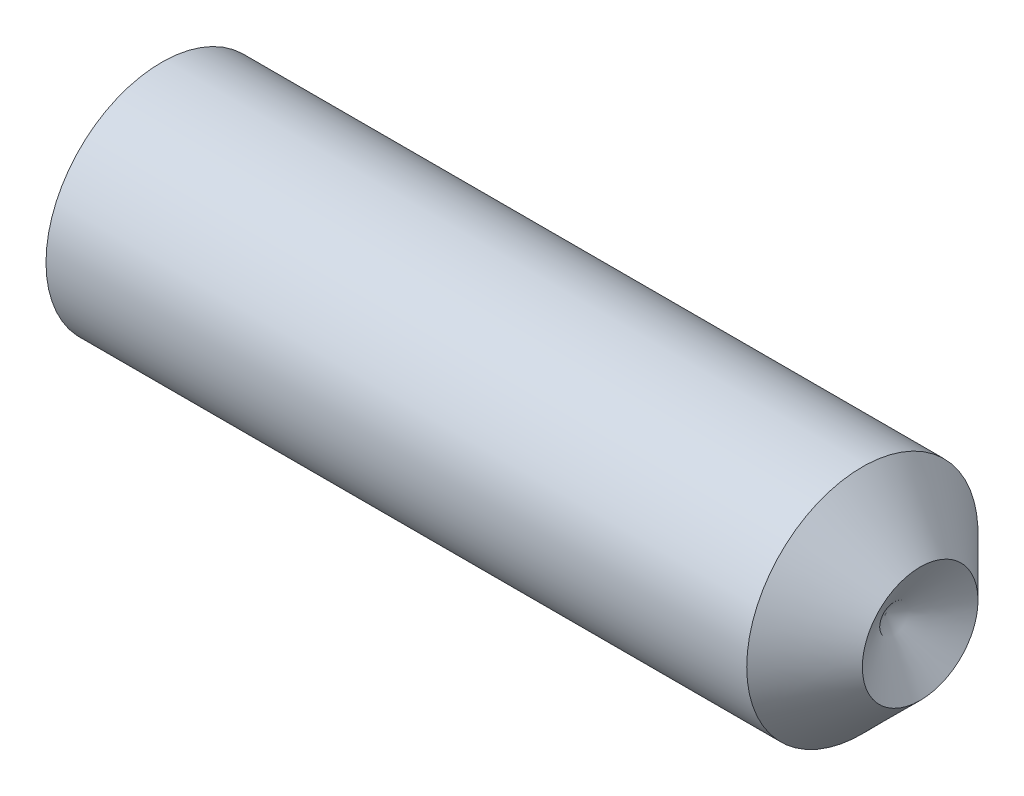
SolidWorks part; units mm, degrees
ref_plane "Plane1" through (0, 0, 0) normal (0, 0, 1) x (1, 0, 0)
ref_plane "Plane2" through (0, 0, 0) normal (0, 1, 0) x (1, 0, 0)
ref_plane "Plane3" through (0, 0, 0) normal (1, 0, 0) x (0, 0, -1)
sketch "BodySke" plane through (0, 0, 0) normal (0, 0, 1) x (1, 0, 0)
  line L0 (0, 0) -> (0, 2.4455)
  line L1 (0, 2.4455) -> (0.3201, 3)
  line L2 (0.3201, 3) -> (18.5, 3)
  line L3 (18.5, 3) -> (20, 1.5)
  line L4 (19.0987, 0) -> (0, 0)
  line L5 (-12.7, 0) -> (88.9, 0) construction
  line L6 (19.0987, 0) -> (20, 1.5)
  line L7 (20, 1.5) -> (20, 11.025) construction
  line L8 (0, -2.4455) -> (0.3201, -3) construction
  line L9 (19.0987, 0) -> (20, -1.5) construction
  line L10 (18.5, -3) -> (20, -1.5) construction
  line L11 (1, 15.875) -> (1, -3.175) construction
  dimension "Length" = 20
  dimension "Diameter" = 6
  dimension "Drive_ch_ang" = 60
  dimension "Minor_dia" = 4.891
  dimension "Cup_nose_ang" = 45
  dimension "Cup_ang" = 118
  dimension "Cup_dia" = 3
  dimension "Advance" = 1
revolve "BaseBody" add sketch "BodySke" angle 360 about L5
sketch "Sketch2" plane through (0, 0, 0) normal (-1, 0, 0) x (0, 0, 1)
  line L0 (0.866, 1.5) -> (-0.866, 1.5)
  line L1 (-0.866, 1.5) -> (-1.7321, 0)
  line L2 (0.866, 1.5) -> (1.7321, 0)
  line L3 (0.866, -1.5) -> (1.7321, 0)
  line L4 (0.866, -1.5) -> (-0.866, -1.5)
  line L5 (-0.866, -1.5) -> (-1.7321, 0)
  dimension "Hex_size" = 3
  dimension "D2" = 1.5
  dimension "D3" = 1.5
extrude "Hex" cut sketch "Sketch2" against normal blind 3
sketch "Sketch4" plane through (0, 4.7709, -0.5249) normal (-1, 0, 0) x (0, 0, 1)
  line L0 (0.5249, -4.7709) -> (2.4174, -4.7709)
  line L1 (0.5249, -4.7709) -> (6.6732, -1.2211) construction
  line L2 (0.5249, -4.7709) -> (1.4711, -3.1319)
  line L3 (2.0911, -4.336) -> (2.3288, -4.1987)
  line L4 (1.6846, -3.6319) -> (1.9223, -3.4947)
  arc A0 (2.0911, -4.336) -> (1.6846, -3.6319) centre (0.5249, -4.7709) ccw
  arc A1 (2.4174, -4.7709) -> (2.3288, -4.1987) centre (0.5249, -4.7709) ccw
  arc A2 (1.4711, -3.1319) -> (1.9223, -3.4947) centre (0.5249, -4.7709) cw
  circle A3 centre (0.5249, -4.7709) radius 1.6255 construction
  circle A4 centre (0.5249, -4.7709) radius 1.8925 construction
  dimension "D1" = 30
  dimension "Spline_n_dim" = 3.251
  dimension "Spline_m_dim" = 3.785
  dimension "Spline_a_dim" = 60
  dimension "D3" = 0.4065
  dimension "Spline_p_dim" = 0.813
extrude "Spline6" [suppressed] cut sketch "Sketch4" against normal blind 3
pattern_circular "CirPattern1" [suppressed] count 6 every 60 about axis through (-12.7, 0, 0) along (1, 0, 0)
sketch "Sketch5" plane through (0, 1.5227, 6.1981) normal (-1, 0, 0) x (0, 0, 1)
  line L0 (-6.1981, -1.5227) -> (-4.3056, -1.5227)
  line L1 (-6.1981, -1.5227) -> (-1.178, 3.4975) construction
  line L2 (-6.1981, -1.5227) -> (-6.1981, 0.3698)
  line L3 (-4.7612, -0.6607) -> (-4.6037, -0.5031)
  line L4 (-5.3361, -0.0858) -> (-5.1786, 0.0718)
  line L5 (-5.3361, -0.0858) -> (-4.7612, -0.6607)
  arc A1 (-4.3056, -1.5227) -> (-4.6037, -0.5031) centre (-6.1981, -1.5227) ccw
  arc A2 (-6.1981, 0.3698) -> (-5.1786, 0.0718) centre (-6.1981, -1.5227) cw
  circle A3 centre (-6.1981, -1.5227) radius 1.6255 construction
  circle A4 centre (-6.1981, -1.5227) radius 1.8925 construction
  dimension "D1" = 45
  dimension "Spline_n_dim" = 3.251
  dimension "Spline_m_dim" = 3.785
  dimension "Spline_a_dim" = 90
  dimension "D3" = 0.4065
  dimension "Spline_p_dim" = 0.813
extrude "Spline4" [suppressed] cut sketch "Sketch5" against normal blind 3
pattern_circular "CirPattern2" [suppressed] count 4 every 90 about axis through (-12.7, 0, 0) along (1, 0, 0)
sketch "ThdSchSke" plane through (0, 0, 0) normal (0, 0, 1) x (1, 0, 0)
  line L0 (0.3201, -2.4455) -> (-0.0681, -3)
  line L1 (0.3201, -2.4455) -> (0.7084, -3)
  line L2 (0.7084, -3) -> (0.7084, -3.75)
  line L3 (-3.175, 0) -> (5.1513, 0) construction
  line L4 (0.3201, 3) -> (0.3201, -3) construction
  line L5 (0.7084, -3.75) -> (-0.0681, -3.75)
  line L6 (-0.0681, -3.75) -> (-0.0681, -3)
  dimension "Thread_minor" = 4.891
  dimension "Diameter" = 6
  dimension "SideAngle" = 55
  dimension "VeeAngle" = 70
  dimension "Overcut" = 7.5
revolve "ThreadSchematic" [suppressed] cut sketch "ThdSchSke" angle 360 about L3
pattern_linear "ThdSchPat" [suppressed]
equation "\"D2@Sketch2\" = \"Hex_size@Sketch2\" / 2"
equation "\"D3@Sketch2\" = \"Hex_size@Sketch2\" / 2"
equation "\"Thread_minor@ThreadCosmetic\" = \"Minor_dia@BodySke\""
equation "\"D1@Sketch4\" = \"Spline_a_dim@Sketch4\" / 2"
equation "\"D3@Sketch4\" = \"Spline_p_dim@Sketch4\" / 2"
equation "\"D2@CirPattern1\" = \"Spline_a_dim@Sketch4\""
equation "\"Num_teeth@CirPattern1\" = 360 / \"D2@CirPattern1\""
equation "\"Spline_a_dim@Sketch5\" = 90"
equation "\"Spline_p_dim@Sketch5\" = \"Spline_p_dim@Sketch4\""
equation "\"Spline_m_dim@Sketch5\" = \"Spline_m_dim@Sketch4\""
equation "\"Spline_n_dim@Sketch5\" = \"Spline_n_dim@Sketch4\""
equation "\"D1@Sketch5\" = \"Spline_a_dim@Sketch5\" / 2"
equation "\"D3@Sketch5\" = \"Spline_p_dim@Sketch5\" / 2"
equation "\"Key_eng@Spline4\" = \"Key_eng@Spline6\""
equation "\"Thread_minor@ThdSchSke\" = \"Thread_minor@ThreadCosmetic\""
equation "\"Diameter@ThdSchSke\" = \"Diameter@BodySke\""
equation "\"Overcut@ThdSchSke\" = \"Diameter@BodySke\" * 1.25"
equation "\"Num_threads@ThdSchPat\" = int( (\"Length@BodySke\" - ( ( ( \"Diameter@BodySke\" - \"Minor_dia@BodySke\" ) * 0.5 ) / tan( \"Drive_ch_ang@BodySke\" * 0.017453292 ) ) - ( ( ( \"Diameter@BodySke\" - \"Cup_dia@BodySk"
equation "\"Advance@ThdSchPat\" = (\"Length@BodySke\" - ( ( ( \"Diameter@BodySke\" - \"Minor_dia@BodySke\" ) * 0.5 ) / tan( \"Drive_ch_ang@BodySke\" * 0.017453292 ) ) - ( ( ( \"Diameter@BodySke\" - \"Cup_dia@BodySke\" ) * 0."
equation "' \"Num_threads@ThdSchPat\" = \"Num_threads@ThdSchPat\" - sgn( \"Num_threads@ThdSchPat\" - 1) '---chamfered tips only---"
